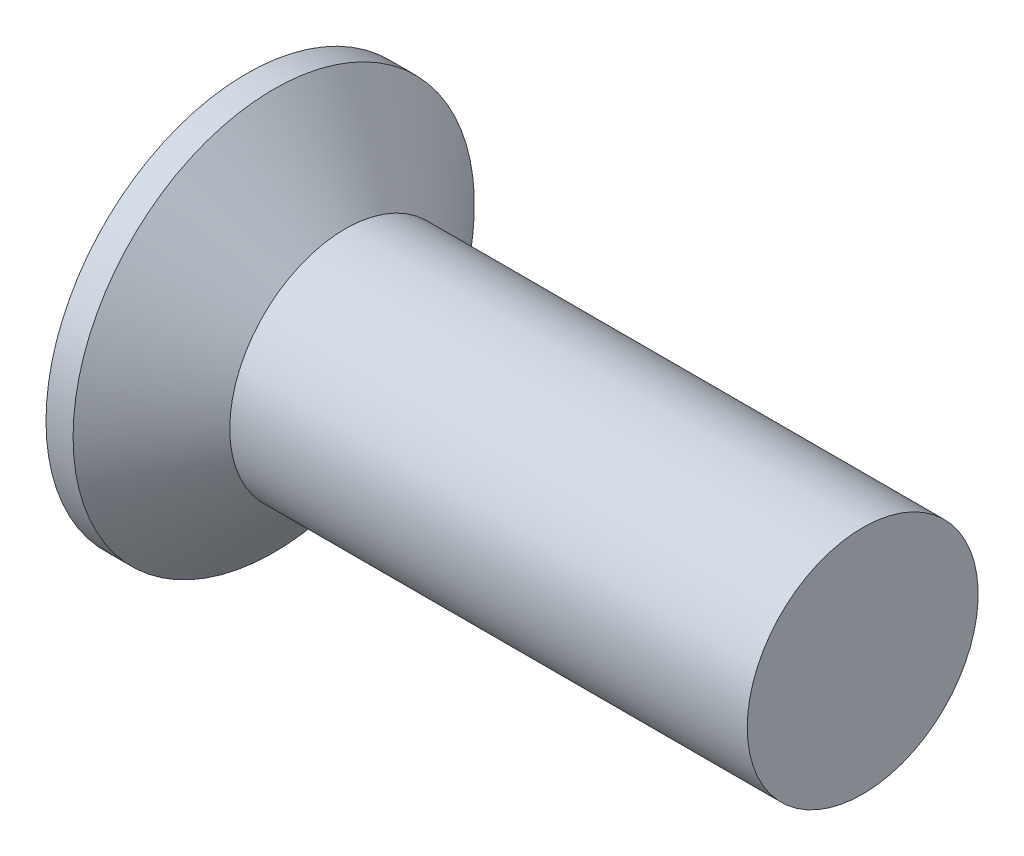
SolidWorks part; units mm, degrees
revolve "Base-Revolve" add sketch "BodySke" angle 360 about L5
sketch "BodySke" plane through (0, 0, 0) normal (0, 0, 1) x (1, 0, 0)
  line L0 (0, 0) -> (0, 3.6195)
  line L1 (0, 3.6195) -> (0.4886, 3.6195)
  line L2 (1.778, 2.0828) -> (11.1125, 2.0828)
  line L3 (11.1125, 2.0828) -> (11.1125, 0)
  line L4 (11.1125, 0) -> (0, 0)
  line L5 (-6.35, 0) -> (82.55, 0) construction
  line L6 (1.778, -2.0828) -> (11.1125, -2.0828) construction
  line L7 (0.4886, -3.6195) -> (1.778, -2.0828) construction
  line L8 (0.4886, 3.6195) -> (1.778, 2.0828)
  line L9 (0, -3.6195) -> (0.4886, -3.6195) construction
  line L10 (2.5705, 3.6703) -> (2.5705, -5.8547) construction
  line L11 (0, 6.35) -> (0, -3.175) construction
extrude "Slot" cut sketch "Sketch2" against normal blind 0.9144
sketch "Sketch2" plane through (0, 0, 0) normal (-1, 0, 0) x (0, 0, 1)
  line L0 (-3.6195, -0.6858) -> (3.6195, -0.6858)
  line L1 (-3.6195, -0.6858) -> (-3.6195, 0.6858)
  line L2 (3.6195, 0.6858) -> (-3.6195, 0.6858)
  line L3 (3.6195, 0.6858) -> (3.6195, -0.6858)
ref_plane "Plane1" through (0, 0, 0) normal (0, 0, 1) x (1, 0, 0)
ref_plane "Plane2" through (0, 0, 0) normal (0, 1, 0) x (1, 0, 0)
ref_plane "Plane3" through (0, 0, 0) normal (1, 0, 0) x (0, 0, -1)
other "Configuration Table"
sketch "Sketch3" plane through (0, 0, 0) normal (-1, 0, 0) x (0, 0, 1)
  line L0 (-0.4699, 2.4257) -> (0.4699, 2.4257)
  line L1 (0.4699, 2.4257) -> (0.4699, -2.4257)
  line L2 (0.4699, -2.4257) -> (-0.4699, -2.4257)
  line L3 (-0.4699, -2.4257) -> (-0.4699, 2.4257)
ref_plane "Plane4" through (3.1496, 0, 0) normal (-1, 0, 0) x (0, 0, 1)
sketch "Sketch4" plane through (3.1496, 0, 0) normal (-1, 0, 0) x (0, 0, 1)
  line L0 (-0.2349, 0.2349) -> (0.2349, 0.2349)
  line L3 (0.2349, 0.2349) -> (0.235, -0.2349)
  line L4 (0.235, -0.2349) -> (-0.2349, -0.235)
  line L5 (-0.2349, -0.235) -> (-0.2349, 0.2349)
loft "Cross" cut profiles "Sketch3", "Sketch4"
pattern_circular "CirPattern1" count 2 every 90 about axis through (0, 0, 0) along (1, 0, 0) of "Cross"
sketch "ThdSchSke" plane through (0, 0, 0) normal (0, 0, 1) x (1, 0, 0)
  line L0 (2.5705, -1.6104) -> (2.2397, -2.0828)
  line L1 (2.5705, -1.6104) -> (2.9013, -2.0828)
  line L2 (2.9013, -2.0828) -> (2.9013, -2.6035)
  line L3 (-3.175, 0) -> (5.1513, 0) construction
  line L5 (2.9013, -2.6035) -> (2.2397, -2.6035)
  line L6 (2.2397, -2.6035) -> (2.2397, -2.0828)
  line L7 (0, 3.6195) -> (0, -3.6195) construction
revolve "ThreadSchematic" [suppressed] cut sketch "ThdSchSke" angle 360 about L3
pattern_linear "ThdSchPat" [suppressed]
equation "\"D1@Sketch3\" = \"Cross_dia@Sketch3\" / 2"
equation "\"D2@Sketch3\" = \"Cross_width@Sketch3\" / 2"
equation "\"D1@Sketch4\" = \"Cross_width@Sketch3\" *.5"
equation "\"D2@Sketch4\" = \"D1@Sketch4\""
equation "\"D4@Sketch4\" = \"D2@Sketch4\" / 2"
equation "\"D3@Sketch4\" = \"D1@Sketch4\" / 2"
equation "\"D1@Sketch2\" = \"Slot_width@Sketch2\" / 2"
equation "\"D2@Sketch2\" = \"Head_dia@BodySke\""
equation "\"D3@Sketch2\" = \"D2@Sketch2\" / 2"
equation "\"Thread_length@ThreadCosmetic\" = ((sgn( (\"Length@BodySke\" - \"Advance@BodySke\" - \"Head_ht@BodySke\" ) - \"Thread_nom@BodySke\" )-1)*( (\"Length@BodySke\" - \"Advance@BodySke\" - \"Head_ht@BodySke\" ) - \"Thread_"
equation "\"Thread_minor@ThdSchSke\" = \"Thread_minor@ThreadCosmetic\""
equation "\"Diameter@ThdSchSke\" = \"Diameter@BodySke\""
equation "\"Overcut@ThdSchSke\" = \"Diameter@BodySke\" * 1.25"
equation "\"Start@ThdSchSke\" = 0.000001 + \"Length@BodySke\" - \"Thread_length@ThreadCosmetic\"  '---Countersunk---"
equation "\"Num_threads@ThdSchPat\" = int( \"Thread_length@ThreadCosmetic\" / \"Advance@BodySke\" + 0.999 )  + 1"
equation "\"Advance@ThdSchPat\" = \"Thread_length@ThreadCosmetic\" /  (\"Num_threads@ThdSchPat\" - 1) 'relax it"
